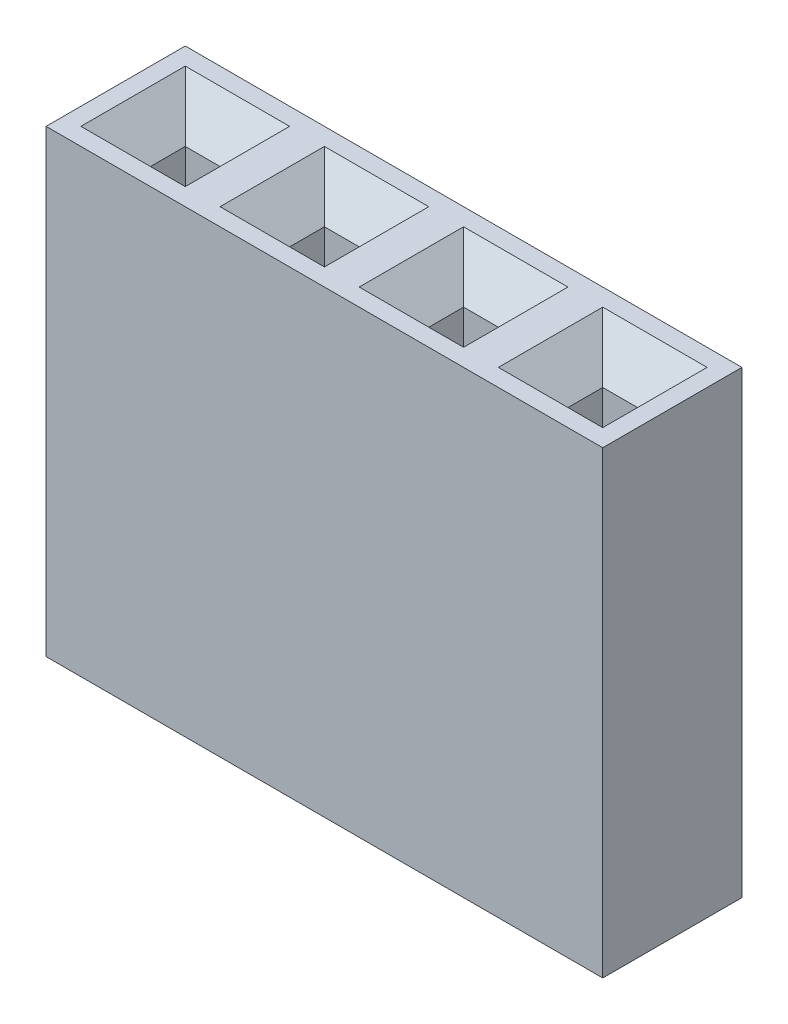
SolidWorks part; units mm, degrees
ref_plane "Front Plane" through (0, 0, 0) normal (0, 0, 1) x (1, 0, 0)
ref_plane "Top Plane" through (0, 0, 0) normal (0, 1, 0) x (1, 0, 0)
ref_plane "Right Plane" through (0, 0, 0) normal (1, 0, 0) x (0, 0, -1)
sketch "Sketch1" plane through (0, 0, 0) normal (0, 1, 0) x (1, 0, 0)
  line L0 (-1.27, -1.27) -> (1.27, 1.27) construction
  line L1 (-1.27, -1.27) -> (1.27, -1.27)
  line L2 (-1.27, -1.27) -> (-1.27, 1.27)
  line L3 (-1.27, 1.27) -> (1.27, 1.27)
  line L4 (1.27, -1.27) -> (1.27, 1.27)
  line L5 (-0.3175, -0.3175) -> (0.3175, -0.3175)
  line L6 (-0.3175, -0.3175) -> (-0.3175, 0.3175)
  line L7 (-0.3175, 0.3175) -> (0.3175, 0.3175)
  line L8 (0.3175, -0.3175) -> (0.3175, 0.3175)
  line L9 (-1.27, 1.27) -> (1.27, -1.27) construction
  point P4 (0, 0)
  point P9 (0, 0)
  dimension "D1" = 2.54
  dimension "D2" = 2.54
  dimension "D3" = 0.635
  dimension "D4" = 0.635
extrude "Boss-Extrude1" add sketch "Sketch1" along normal blind 8.382
sketch "Sketch2" plane through (0, 8.382, 0) normal (0, 1, 0) x (1, 0, 0)
  line L1 (0.9525, -0.9525) -> (-0.9525, -0.9525)
  line L2 (0.9525, -0.9525) -> (0.9525, 0.9525)
  line L3 (0.9525, 0.9525) -> (-0.9525, 0.9525)
  line L4 (-0.9525, -0.9525) -> (-0.9525, 0.9525)
  line L5 (0.9525, -0.9525) -> (-0.9525, 0.9525) construction
  line L6 (0.9525, 0.9525) -> (-0.9525, -0.9525) construction
  point P0 (0, 0)
  dimension "D1" = 1.905
  dimension "D2" = 1.905
ref_plane "Plane1" through (0, 7.747, 0) normal (0, 1, 0) x (-1, 0, 0)
sketch "Sketch3" plane through (0, 7.747, 0) normal (0, 1, 0) x (-1, 0, 0)
  line L1 (-0.3175, 0.3175) -> (0.3175, 0.3175)
  line L2 (-0.3175, 0.3175) -> (-0.3175, -0.3175)
  line L3 (-0.3175, -0.3175) -> (0.3175, -0.3175)
  line L4 (0.3175, 0.3175) -> (0.3175, -0.3175)
  line L5 (-0.3175, 0.3175) -> (0.3175, -0.3175) construction
  line L6 (-0.3175, -0.3175) -> (0.3175, 0.3175) construction
  point P0 (0, 0)
loft "Cut-Loft1" cut profiles "Sketch3", "Sketch2"
pattern_linear "4 pins" count 4 spacing 2.54 along (-1, 0, 0) of "Boss-Extrude1", "Cut-Loft1"
pattern_linear "6 pins" [suppressed] count 6 spacing 2.54
pattern_linear "8 pins" [suppressed] count 8 spacing 2.54
